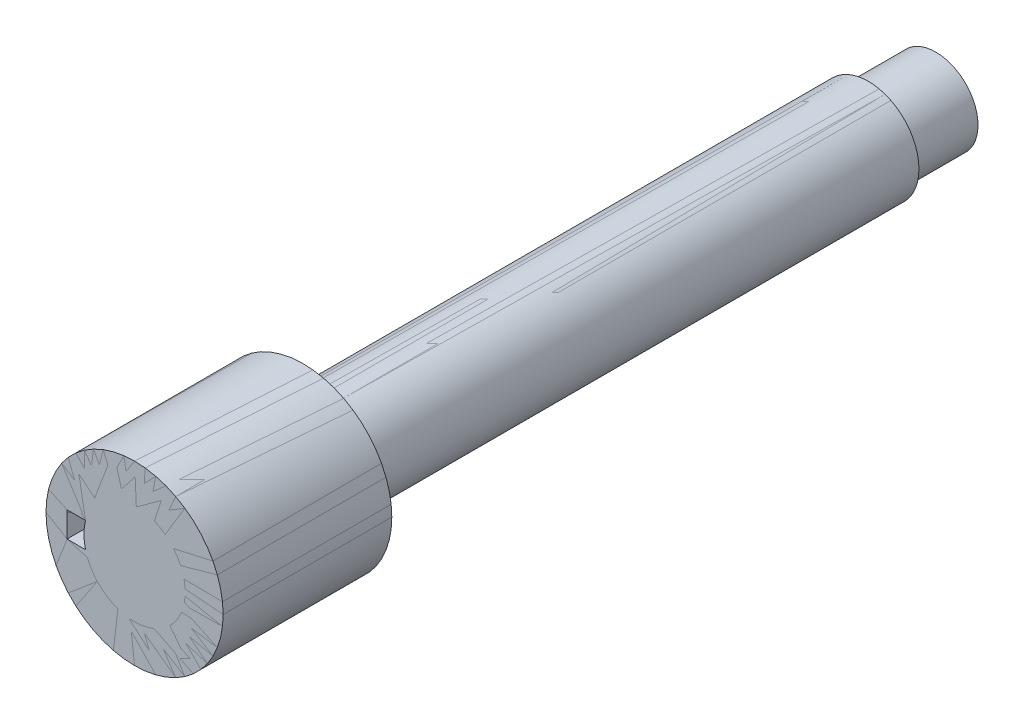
SolidWorks part; units mm, degrees
ref_plane "Plan de face" through (0, 0, 0) normal (0, 0, 1) x (1, 0, 0)
ref_plane "Plan de dessus" through (0, 0, 0) normal (0, 1, 0) x (1, 0, 0)
ref_plane "Plan de droite" through (0, 0, 0) normal (1, 0, 0) x (0, 0, -1)
imported_body " Importée1"
sketch "Esquisse1" plane through (0, 0, -182) normal (0, 0, -1) x (-1, 0, 0)
  circle A0 centre (0, 0) radius 10
extrude "Extrusion1" add sketch "Esquisse1" along normal blind 16
sketch "Esquisse2" plane through (0, 0, 0) normal (0, 1, 0) x (1, 0, 0)
  line L0 (12, 43) -> (0, 43)
  line L1 (0, 43) -> (0, 8)
  line L2 (0, 8) -> (12, 8)
  line L3 (12, 8) -> (12, 43)
  line L4 (0, 43) -> (0, 8) construction
revolve "Enlèvement de matière-Révolution1" cut sketch "Esquisse2" angle 360 about L4
